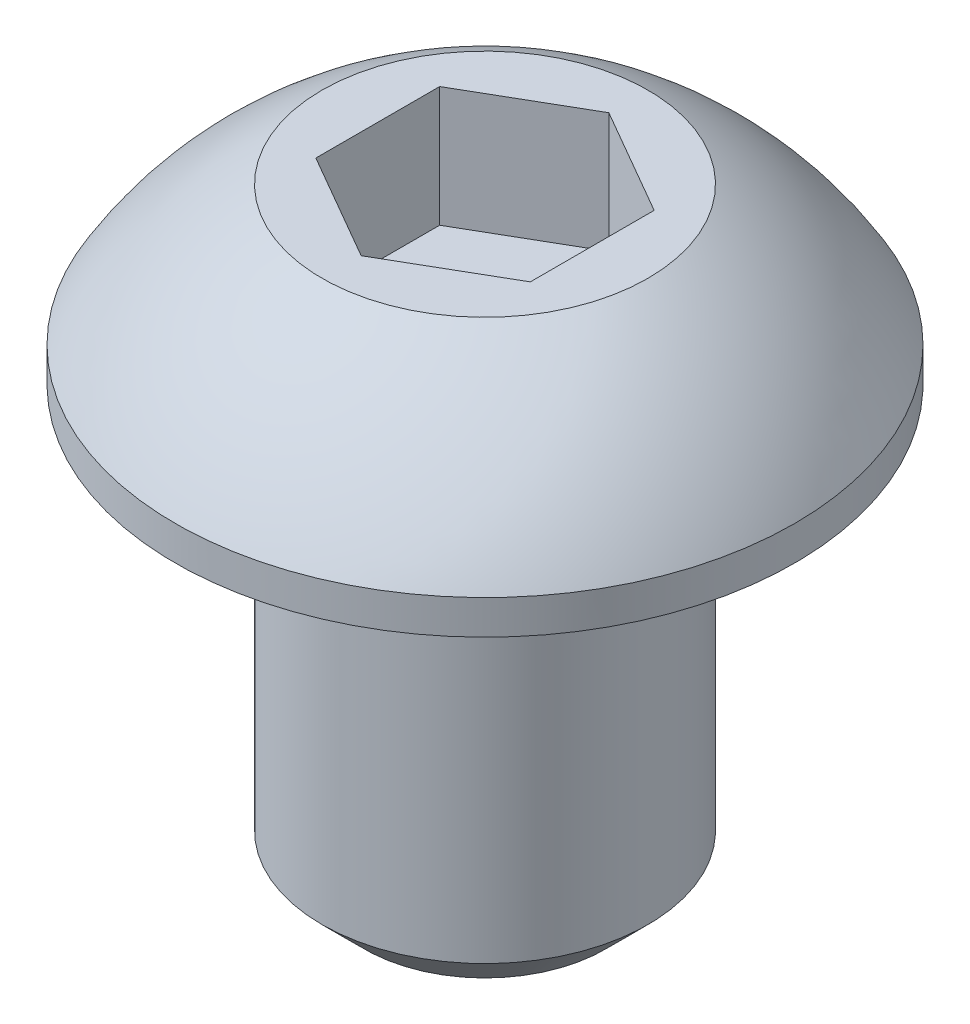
SolidWorks part; units mm, degrees
ref_plane "Front" through (0, 0, 0) normal (0, 0, 1) x (1, 0, 0)
ref_plane "Top" through (0, 0, 0) normal (0, 1, 0) x (1, 0, 0)
ref_plane "Right" through (0, 0, 0) normal (1, 0, 0) x (0, 0, -1)
sketch "Sketch1" plane through (0, 0, 0) normal (0, 0, 1) x (1, 0, 0)
  line L0 (0, 0) -> (4.5847, 0)
  line L1 (4.5847, 0) -> (4.5847, 0.508)
  line L2 (2.413, 2.5654) -> (0, 2.5654)
  line L3 (0, 2.5654) -> (0, 0)
  line L4 (0, 0) -> (0, 100) construction
  arc A0 (4.5847, 0.508) -> (2.413, 2.5654) centre (0, -2.1565) ccw
revolve "Base-Revolve" add sketch "Sketch1" angle 360 about L4
sketch "Sketch2" plane through (0, 0, 0) normal (0, 0, 1) x (1, 0, 0)
  line L0 (0, 0) -> (0, 100) construction
  line L1 (0, -6.35) -> (1.7831, -6.35)
  line L2 (1.7831, -6.35) -> (2.413, -5.7201)
  line L3 (2.413, -5.7201) -> (2.413, 0)
  line L4 (2.413, 0) -> (0, 0)
  line L5 (0, 0) -> (0, -6.35)
revolve "Boss-Revolve1" add sketch "Sketch2" angle 360 about L0
ref_plane "Plane4" through (0, 2.5654, 0) normal (0, 1, 0) x (-1, 0, 0)
sketch "Sketch3" plane through (0, 2.5654, 0) normal (0, 1, 0) x (-1, 0, 0)
  line L0 (1.5875, 0.9165) -> (0, 1.8331)
  line L1 (0, 1.8331) -> (-1.5875, 0.9165)
  line L2 (-1.5875, 0.9165) -> (-1.5875, -0.9165)
  line L3 (-1.5875, -0.9165) -> (0, -1.8331)
  line L4 (0, -1.8331) -> (1.5875, -0.9165)
  line L5 (1.5875, -0.9165) -> (1.5875, 0.9165)
extrude "Cut-Extrude1" cut sketch "Sketch3" against normal blind 1.778
